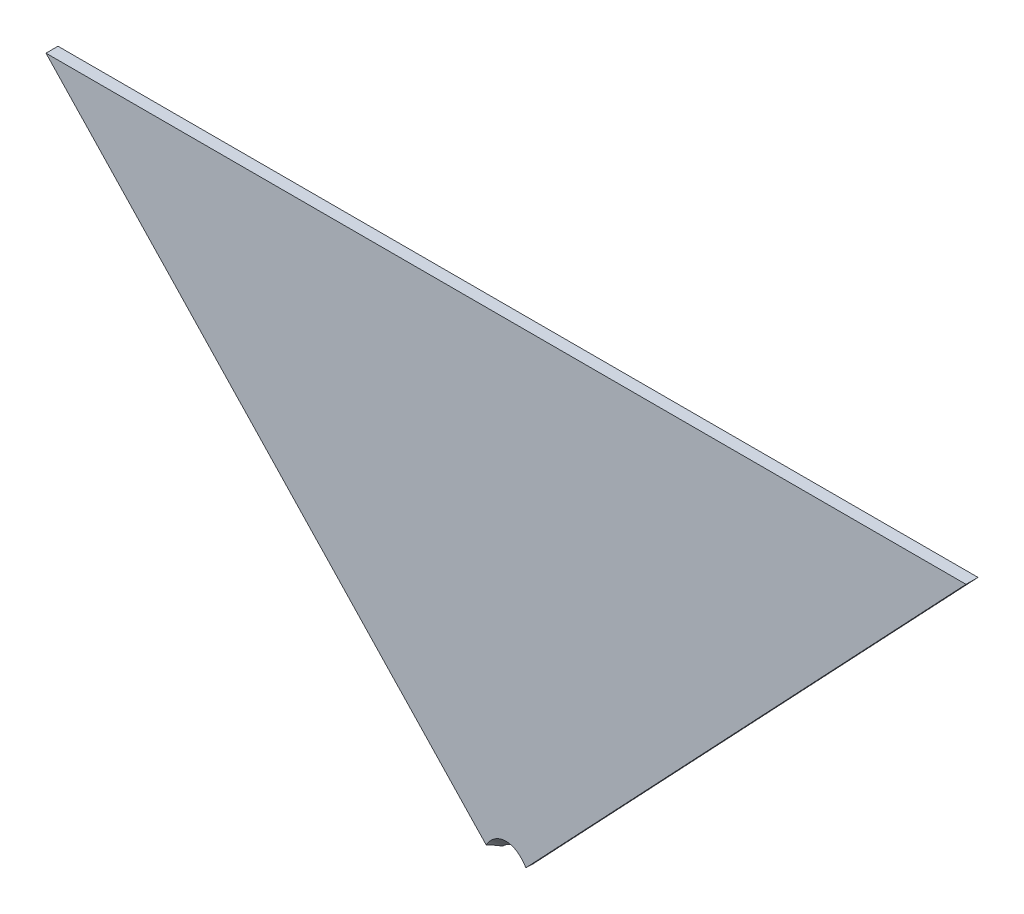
SolidWorks part; units mm, degrees
ref_plane "Ebene vorne" through (0, 0, 0) normal (0, 0, 1) x (1, 0, 0)
ref_plane "Ebene oben" through (0, 0, 0) normal (0, 1, 0) x (1, 0, 0)
ref_plane "Ebene rechts" through (0, 0, 0) normal (1, 0, 0) x (0, 0, -1)
sketch "Skizze1" plane through (0, 0, 0) normal (0, 0, 1) x (1, 0, 0)
  line L0 (-284.0662, 9.706) -> (290.9338, -598.504)
  line L1 (290.9338, -598.504) -> (865.9338, 9.706)
  line L2 (290.9338, -82.1462) -> (290.9338, 49917.8538) construction
  line L3 (-284.0662, 9.706) -> (49715.9338, 9.706) construction
  line L4 (-284.0662, 9.706) -> (865.9338, 9.706)
  dimension "D1" = 575
  dimension "D2" = 575
  dimension "D3" = 608.21
extrude "Aufsatz-Linear austragen1" add sketch "Skizze1" along normal blind 15
sketch "Skizze4" plane through (303.3343, -960.0959, 896.8068) normal (0, 0.6727, 0.7399) x (1, 0, 0)
  circle A0 centre (-12.4005, 860.7627) radius 31.5
extrude "Schnitt-Linear austragen3" cut sketch "Skizze4" against normal through all
